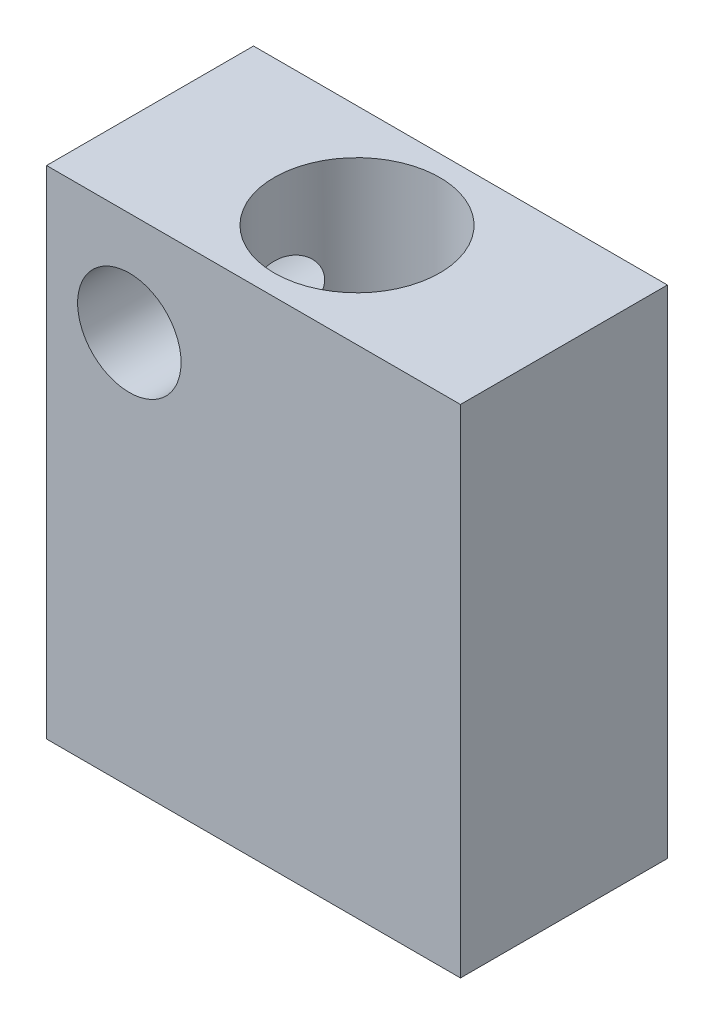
SolidWorks part; units mm, degrees
ref_plane "Front Plane" through (0, 0, 0) normal (0, 0, 1) x (1, 0, 0)
ref_plane "Top Plane" through (0, 0, 0) normal (0, 1, 0) x (1, 0, 0)
ref_plane "Right Plane" through (0, 0, 0) normal (1, 0, 0) x (0, 0, -1)
sketch "Sketch2" plane through (0, 0, 0) normal (0, 1, 0) x (1, 0, 0)
  line L1 (-50, -25) -> (50, -25)
  line L2 (-50, -25) -> (-50, 25)
  line L3 (-50, 25) -> (50, 25)
  line L4 (50, -25) -> (50, 25)
  line L5 (-50, -25) -> (50, 25) construction
  line L6 (-50, 25) -> (50, -25) construction
  point P0 (0, 0)
  dimension "D1" = 50
  dimension "D2" = 100
extrude "Boss-Extrude1" add sketch "Sketch2" against normal blind 120
sketch "Sketch3" plane through (0, 0, 0) normal (0, 1, 0) x (1, 0, 0)
  circle A0 centre (0, 0) radius 20
  dimension "D1" = 40
extrude "Cut-Extrude1" cut sketch "Sketch3" against normal through all
sketch "Sketch4" plane through (0, 0, 25) normal (0, 0, 1) x (1, 0, 0)
  line L0 (-50, -120) -> (-50, 0) construction
  line L2 (-50, 0) -> (50, 0) construction
  circle A0 centre (-30, -25) radius 12.5
  dimension "D1" = 25
  dimension "D2" = 20
  dimension "D3" = 25
extrude "Cut-Extrude2" cut sketch "Sketch4" against normal through all
sketch "Sketch5" plane through (0, 0, 25) normal (0, 0, 1) x (1, 0, 0)
  line L0 (50, -120) -> (50, 0) construction
  line L1 (-50, -120) -> (50, -120) construction
  circle A0 centre (30, -100) radius 7.5
  dimension "D1" = 15
  dimension "D2" = 20
  dimension "D3" = 20
extrude "Cut-Extrude3" [suppressed] cut sketch "Sketch5" against normal through all
pattern_linear "LPattern1" [suppressed] count 2 spacing 20 count 2 spacing 20
